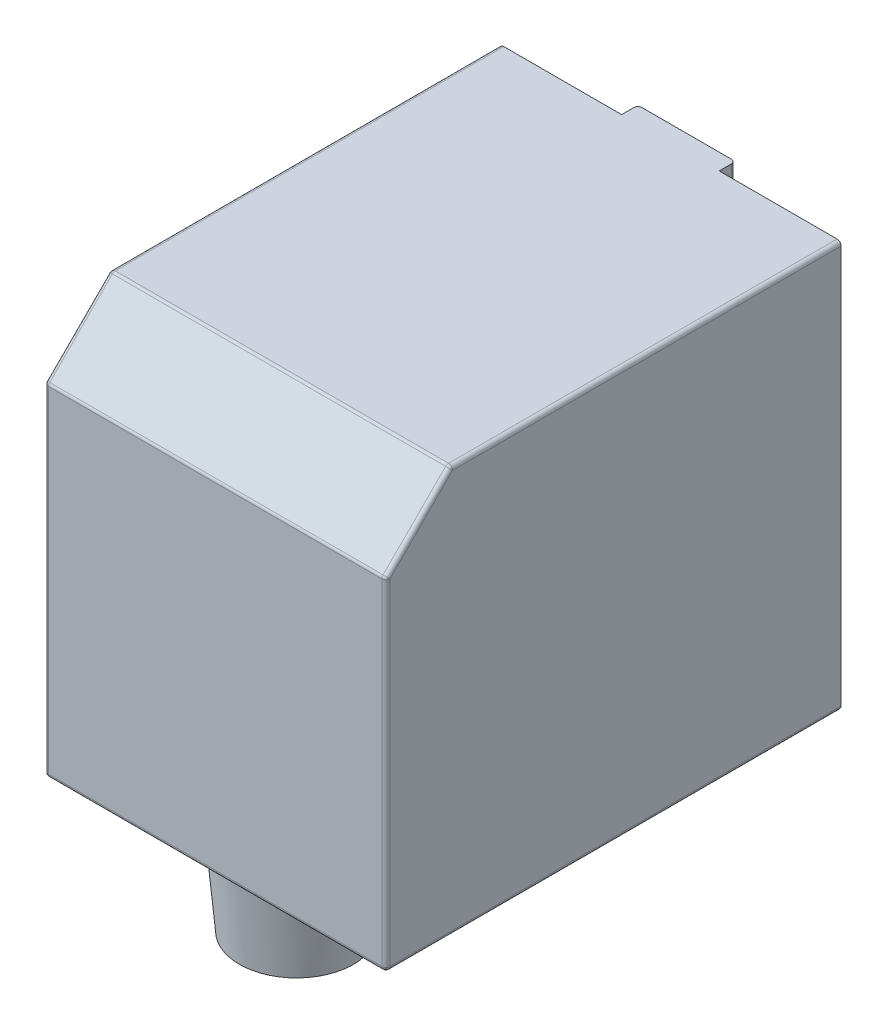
SolidWorks part; units mm, degrees
ref_plane "Plan de face" through (0, 0, 0) normal (0, 0, 1) x (1, 0, 0)
ref_plane "Plan de dessus" through (0, 0, 0) normal (0, 1, 0) x (1, 0, 0)
ref_plane "Plan de droite" through (0, 0, 0) normal (1, 0, 0) x (0, 0, -1)
sketch "Esquisse1" plane through (0, 0, 0) normal (0, 0, 1) x (1, 0, 0)
  line L1 (0, 0) -> (420, 0)
  line L2 (0, 0) -> (0, 500)
  line L3 (0, 500) -> (420, 500)
  line L4 (420, 0) -> (420, 500)
  dimension "D1" = 420
  dimension "D2" = 500
extrude "Extrusion1" add sketch "Esquisse1" along normal blind 560
chamfer "Chanfrein1" distance 80 angle 45 1 edges at (210, 500, 560)
sketch "Esquisse2" plane through (0, 0, 0) normal (0, -1, 0) x (1, 0, 0)
  line L0 (0, 560) -> (0, 0) construction
  line L1 (0, 0) -> (420, 0) construction
  circle A0 centre (210, 460) radius 80
  dimension "D1" = 160
  dimension "D2" = 210
  dimension "D3" = 460
extrude "Extrusion2" add sketch "Esquisse2" along normal blind 110 draft 5
sketch "Esquisse3" plane through (0, -110, 0) normal (0, -1, 0) x (1, 0, 0)
  line L0 (0, 0) -> (420, 0) construction
  line L1 (0, 560) -> (0, 0) construction
  circle A0 centre (210, 460) radius 42.5
  dimension "D1" = 85
  dimension "D2" = 460
  dimension "D3" = 210
extrude "Extrusion3" add sketch "Esquisse3" along normal blind 10
fillet "Congé2" radius 5 12 edges at (420, 210, 560) (0, 210, 560) (210, 420, 560) (0, 500, 240) (0, 460, 520) (420, 500, 240) (210, 500, 480) (420, 460, 520) (210, 0, 0) (210, 0, 560) (420, 0, 280) (0, 0, 280)
sketch "Esquisse4" plane through (0, -120, 0) normal (0, -1, 0) x (1, 0, 0)
  line L1 (160, 465) -> (260, 465)
  line L2 (160, 465) -> (160, 455)
  line L3 (160, 455) -> (260, 455)
  line L4 (260, 465) -> (260, 455)
  circle A1 centre (210, 460) radius 42.5 construction
  dimension "D2" = 10
  dimension "D1" = 5
  dimension "D3" = 50
  dimension "D4" = 100
extrude "Enlèv. mat.-Extru.3" cut sketch "Esquisse4" against normal blind 5
sketch "Esquisse5" plane through (0, -120, 0) normal (0, -1, 0) x (1, 0, 0)
  circle A0 centre (210, 460) radius 22.5
  dimension "D1" = 45
extrude "Enlèv. mat.-Extru.4" cut sketch "Esquisse5" against normal blind 120 draft 3
sketch "Esquisse7" plane through (0, -115, 0) normal (0, -1, 0) x (1, 0, 0)
  line L0 (252.2049, 465) -> (231.9374, 465) construction
  line L1 (232.238, 465) -> (252.5, 465)
  line L2 (232.238, 465) -> (232.238, 455)
  line L3 (232.238, 455) -> (252.5, 455)
  line L4 (252.5, 465) -> (252.5, 455)
  line L5 (231.9374, 455) -> (252.2049, 455) construction
  arc A0 (231.6686, 455) -> (231.6686, 465) centre (210, 460) ccw construction
  arc A1 (252.2049, 455) -> (252.2049, 465) centre (210, 460) ccw construction
extrude "Extrusion4" add sketch "Esquisse7" along normal blind 10
sketch "Esquisse9" plane through (0, 0, 0) normal (0, 0, -1) x (-1, 0, 0)
  line L0 (-415, 500) -> (-5, 500) construction
  line L1 (-270, 500) -> (-150, 500)
  line L2 (-270, 500) -> (-270, 5)
  line L3 (-270, 5) -> (-150, 5)
  line L4 (-150, 500) -> (-150, 5)
  line L5 (-420, 5) -> (0, 5) construction
  line L6 (0, 495) -> (0, 5) construction
  dimension "D1" = 120
  dimension "D2" = 150
extrude "Extrusion5" add sketch "Esquisse9" along normal blind 20
fillet "Congé3" radius 5 2 edges at (270, 252.5, -20) (150, 252.5, -20)
